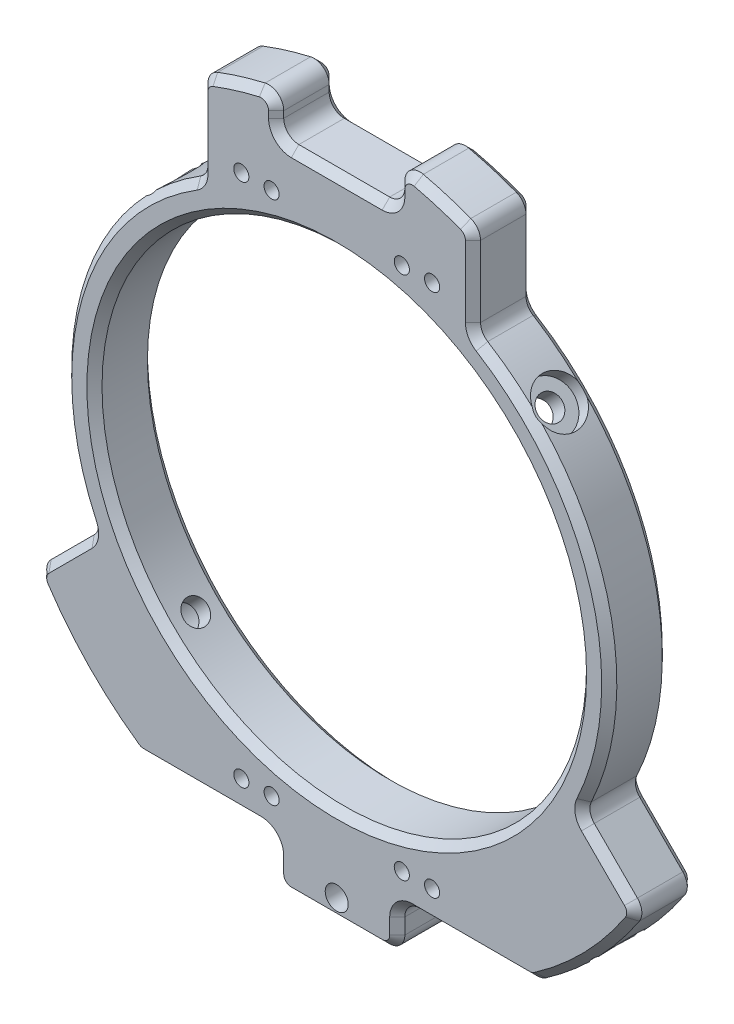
SolidWorks part; units mm, degrees
ref_plane "Front" through (0, 0, 0) normal (0, 0, 1) x (1, 0, 0)
ref_plane "Top" through (0, 0, 0) normal (0, 1, 0) x (1, 0, 0)
ref_plane "Right" through (0, 0, 0) normal (1, 0, 0) x (0, 0, -1)
ref_plane "Plane1" through (0, 0, -6.35) normal (0, 0, 1) x (1, 0, 0)
sketch "Sketch1" plane through (0, 0, 0) normal (0, 0, 1) x (1, 0, 0)
  circle A0 centre (0, 0) radius 74.0918
  circle A1 centre (0, 0) radius 50.8
  dimension "D1" = 148.1836
  dimension "D2" = 101.6
extrude "Boss-Extrude1" add sketch "Sketch1" along normal mid plane 12.7
ref_plane "Plane2" through (0, 0, 0) normal (0.7071, 0.7071, 0) x (0, 0, -1)
ref_plane "Plane3" through (52.3908, 52.3908, 0) normal (0.7071, 0.7071, 0) x (-0.7071, 0.7071, 0)
sketch "Sketch6" plane through (0, 0, 0) normal (0.7071, 0.7071, 0) x (0, 0, -1)
  circle A0 centre (0, 0) radius 2.5146
  circle A1 centre (0, 0) radius 4.7625 construction
  dimension "D1" = 5.0292
  dimension "D2" = 9.525
extrude "Cut-Extrude5" cut sketch "Sketch6" against normal through all and the other way through all
hole_wizard "CBORE for #10 Button Head Cap Screw1" positions "Sketch9" profile "Sketch8" counterbore size "#10" standard "Ansi Inch"
sketch "Sketch9" plane through (52.3908, 52.3908, 0) normal (0.7071, 0.7071, 0) x (-0.7071, 0.7071, 0)
  point P1 (0, 0)
sketch "Sketch8" plane through (52.3908, 52.3908, 0) normal (0, 0, 1) x (-0.7071, 0.7071, 0)
  line L0 (0, 0) -> (0, 52.3338)
  line L1 (0, 52.3338) -> (2.5527, 50.8)
  line L2 (2.5527, 50.8) -> (2.5527, 19.8425)
  line L3 (2.5527, 19.8425) -> (4.9606, 19.8425)
  line L4 (4.9606, 19.8425) -> (4.9606, 0)
  line L5 (4.9606, 0) -> (0, 0)
  line L10 (0, 52.3338) -> (-2.5527, 50.8) construction
  line L11 (0, -6.35) -> (0, 107.95) construction
  circle A1 centre (0, 74.0918) radius 50.8 construction
  dimension "Hole Dia." = 5.1054
  dimension "Hole Depth" = 50.8
  dimension "C'Bore Dia." = 9.9212
  dimension "C'Bore Depth" = 19.8425
  dimension "Drill Angle" = 118
pattern_circular "CirPattern2" count 4 over 360 about axis through (0, 0, 0) along (0, 0, 1) of "CBORE for #10 Button Head Cap Screw1"
sketch "Sketch3" plane through (0, 0, -6.35) normal (0, 0, -1) x (-1, 0, 0)
  line L0 (0, 0) -> (0, -84.5112) construction
  line L1 (-19.05, -67.7418) -> (-12.7, -67.7418) construction
  line L2 (-19.05, -67.7418) -> (-19.05, -80.4418) construction
  line L3 (-19.05, -80.4418) -> (-12.7, -80.4418) construction
  line L4 (-12.7, -67.7418) -> (-12.7, -80.4418) construction
  line L5 (-63.5, -55.0418) -> (-49.5983, -55.0418) construction
  line L6 (-63.5, -55.0418) -> (-63.5, -77.2668) construction
  line L7 (-63.5, -77.2668) -> (-25.4, -77.2668) construction
  line L8 (-25.4, -58.1987) -> (-25.4, -77.2668) construction
  line L9 (0, 0) -> (-20, 0) construction
  line L10 (63.5, -55.0418) -> (63.5, -77.2668) construction
  line L11 (63.5, -55.0418) -> (49.5983, -55.0418) construction
  line L12 (25.4, -58.1987) -> (25.4, -77.2668) construction
  line L13 (63.5, -77.2668) -> (25.4, -77.2668) construction
  line L14 (19.05, -80.4418) -> (12.7, -80.4418) construction
  line L15 (12.7, -67.7418) -> (12.7, -80.4418) construction
  line L16 (19.05, -67.7418) -> (12.7, -67.7418) construction
  line L17 (19.05, -67.7418) -> (19.05, -80.4418) construction
  line L27 (19.05, 67.7418) -> (19.05, 80.4418) construction
  line L28 (19.05, 67.7418) -> (12.7, 67.7418) construction
  line L29 (12.7, 67.7418) -> (12.7, 80.4418) construction
  line L30 (19.05, 80.4418) -> (12.7, 80.4418) construction
  line L31 (63.5, 77.2668) -> (25.4, 77.2668) construction
  line L32 (25.4, 58.1987) -> (25.4, 77.2668) construction
  line L33 (63.5, 55.0418) -> (49.5983, 55.0418) construction
  line L34 (63.5, 55.0418) -> (63.5, 77.2668) construction
  line L35 (-25.4, 58.1987) -> (-25.4, 77.2668) construction
  line L36 (-63.5, 77.2668) -> (-25.4, 77.2668) construction
  line L37 (-63.5, 55.0418) -> (-63.5, 77.2668) construction
  line L38 (-63.5, 55.0418) -> (-49.5983, 55.0418) construction
  line L39 (-12.7, 67.7418) -> (-12.7, 80.4418) construction
  line L40 (-19.05, 80.4418) -> (-12.7, 80.4418) construction
  line L41 (-19.05, 67.7418) -> (-19.05, 80.4418) construction
  line L42 (-19.05, 67.7418) -> (-12.7, 67.7418) construction
  circle A1 centre (0, 0) radius 50.8 construction
  circle A2 centre (-13.65, -55) radius 1.5875
  circle A3 centre (0, -66.675) radius 2.413
  circle A4 centre (13.65, -55) radius 1.5875
  circle A5 centre (20, -55) radius 1.5875
  circle A6 centre (-20, -55) radius 1.5875
  circle A7 centre (20, 55) radius 1.5875
  circle A8 centre (13.65, 55) radius 1.5875
  arc A9 (-25.4, 58.1987) -> (-25.4, -58.1987) centre (0, 0) ccw construction
  circle A10 centre (-13.65, 55) radius 1.5875
  arc A11 (25.4, -58.1987) -> (25.4, 58.1987) centre (0, 0) ccw construction
  circle A12 centre (0, 0) radius 74.0918 construction
  arc A13 (-49.5983, 55.0418) -> (-49.5983, -55.0418) centre (0, 0) ccw construction
  circle A14 centre (-20, 55) radius 1.5875
  arc A15 (49.5983, -55.0418) -> (49.5983, 55.0418) centre (0, 0) ccw construction
  dimension "D9" = 3.175
  dimension "D12" = 12.7
  dimension "D19" = 4.826
  dimension "D20" = 66.675
  dimension "D1" = 6.35
  dimension "D2" = 12.7
  dimension "D3" = 6.35
  dimension "D4" = 55
  dimension "D5" = 12.7
  dimension "D6" = 12.7
  dimension "D7" = 22.225
  dimension "D8" = 38.1
  dimension "D10" = 67.7418
  dimension "D11" = 6.35
  dimension "D16" = 20
extrude "Cut-Extrude2" cut sketch "Sketch3" against normal through all
sketch "Sketch12" plane through (0, 0, 0) normal (0, 0, 1) x (1, 0, 0)
  line L0 (0, 0) -> (0, 74.0918) construction
  line L1 (0, 0) -> (52.3908, -52.3908) construction
  line L2 (74.0918, 0) -> (0, 0) construction
  line L3 (0, 0) -> (-52.3908, -52.3908) construction
  line L4 (-12.7, 74.0918) -> (-12.7, 64.5668)
  line L5 (-12.7, 74.0918) -> (12.7, 74.0918)
  line L6 (36.6961, -61.3918) -> (38.5671, -63.2628)
  line L7 (0, 0) -> (0, -74.0918) construction
  line L8 (50.8263, -26.1306) -> (63.2628, -38.5671)
  line L9 (-28.575, 68.3598) -> (-28.575, 49.4934)
  line L10 (-36.6961, -61.3918) -> (-38.5671, -63.2628)
  line L11 (28.575, 68.3598) -> (28.575, 49.4934)
  line L12 (-12.7, 64.5668) -> (12.7, 64.5668)
  line L13 (12.7, 64.5668) -> (12.7, 74.0918)
  line L14 (-36.6961, -61.3918) -> (-12.7, -61.3918)
  line L15 (12.7, 74.0918) -> (28.575, 74.0918) construction
  line L16 (-50.8263, -26.1306) -> (-63.2628, -38.5671)
  line L17 (-12.7, -61.3918) -> (-12.7, -71.0438)
  line L18 (12.7, -61.3918) -> (12.7, -71.0438)
  line L19 (12.7, -61.3918) -> (36.6961, -61.3918)
  line L20 (-12.7, -71.0438) -> (12.7, -71.0438)
  arc A0 (50.8263, -26.1306) -> (28.575, 49.4934) centre (0, 0) ccw
  arc A1 (63.2628, -38.5671) -> (28.575, 68.3598) centre (0, 0) ccw
  circle A2 centre (0, 0) radius 74.0918 construction
  circle A3 centre (0, 0) radius 50.8 construction
  arc A4 (-28.575, 49.4934) -> (-50.8263, -26.1306) centre (0, 0) ccw
  arc A5 (-28.575, 68.3598) -> (-63.2628, -38.5671) centre (0, 0) ccw
  arc A6 (-38.5671, -63.2628) -> (38.5671, -63.2628) centre (0, 0) ccw
  arc A8 (-12.7, -69.8994) -> (12.7, -69.8994) centre (0, 0) ccw construction
  point P21 (0, 64.5668)
  dimension "D1" = 6.35
  dimension "D5" = 57.15
  dimension "D11" = 71.0438
  dimension "D12" = 3.048
  dimension "D2" = 45
  dimension "D4" = 34.925
  dimension "D6" = 9.525
  dimension "D7" = 25.4
  dimension "D3" = 45
  dimension "D8" = 28.575
  dimension "D9" = 17.4625
  dimension "D10" = 17.4625
  dimension "D13" = 12.7
extrude "Cut-Extrude7" cut sketch "Sketch12" against normal mid plane 25.4
sketch "Sketch14" plane through (0, 0, 0) normal (0, 0, 1) x (1, 0, 0)
  line L0 (-12.7, -61.3918) -> (-36.6961, -61.3918) construction
  line L1 (-20.3923, -61.3918) -> (-46.0891, -61.3918)
  line L2 (-20.3923, -61.3918) -> (-20.3923, -73.1833)
  line L3 (-20.3923, -73.1833) -> (-46.0891, -73.1833)
  line L4 (-46.0891, -61.3918) -> (-46.0891, -73.1833)
  line L5 (0, 0) -> (0, -79.7524) construction
  line L6 (46.0891, -61.3918) -> (46.0891, -73.1833)
  line L7 (20.3923, -73.1833) -> (46.0891, -73.1833)
  line L8 (20.3923, -61.3918) -> (20.3923, -73.1833)
  line L9 (20.3923, -61.3918) -> (46.0891, -61.3918)
extrude "Cut-Extrude8" cut sketch "Sketch14" against normal mid plane 50.8
fillet "Fillet1" radius 3.175 18 edges at (50.8263, -26.1306, 0) (63.2628, -38.5671, 0) (12.7, -61.3918, 0) (-12.7, -61.3918, 0) (-63.2628, -38.5671, 0) (-50.8263, -26.1306, 0) (-28.575, 49.4934, 0) (-28.575, 68.3598, 0) (-12.7, 72.9952, 0) (12.7, 72.9952, 0) (28.575, 68.3598, 0) (-12.7, 64.5668, 0) (12.7, 64.5668, 0) (28.575, 49.4934, 0) (41.4806, -61.3918, 0) (-41.4806, -61.3918, 0) (12.7, -71.0438, 0) (-12.7, -71.0438, 0)
chamfer "Chamfer1" distance 1.5875 angle 45 74 edges at (-53.0478, -51.7255, 6.35) (-62.379, -38.6932, 6.35) (-28.1859, -61.3918, 6.35) (-56.9478, -32.2521, 6.35) (-13.6299, -62.3217, 6.35) (-51.5486, -26.041, 6.35) (-12.7, -66.2178, 6.35) (-54.7612, 16.3502, 6.35) (-28.9764, 49.7485, 6.35) (-28.575, 58.7529, 6.35) (-28.0164, 68.0106, 6.35) (12.7, -66.2178, 6.35) (-21.6148, 70.8689, 6.35) (13.6299, -62.3217, 6.35) (-13.8971, 71.6008, 6.35) (28.1859, -61.3918, 6.35) (-12.7, 68.4295, 6.35) (-11.7701, 65.4967, 6.35) (0, 64.5668, 6.35) (53.0478, -51.7255, 6.35) (11.7701, 65.4967, 6.35) (62.379, -38.6932, 6.35) (12.7, 68.4295, 6.35) (56.9478, -32.2521, 6.35) (13.8971, 71.6008, 6.35) (51.5486, -26.041, 6.35) (21.6148, 70.8689, 6.35) (54.7612, 16.3502, 6.35) (28.0164, 68.0106, 6.35) (28.9764, 49.7485, 6.35) (28.575, 58.7529, 6.35) (-53.0478, -51.7255, -6.35) (-62.379, -38.6932, -6.35) (-28.1859, -61.3918, -6.35) (-56.9478, -32.2521, -6.35) (-13.6299, -62.3217, -6.35) (-51.5486, -26.041, -6.35) (-12.7, -66.2178, -6.35) (-54.7612, 16.3502, -6.35) (-28.9764, 49.7485, -6.35) (-28.575, 58.7529, -6.35) (-28.0164, 68.0106, -6.35) (12.7, -66.2178, -6.35) (-21.6148, 70.8689, -6.35) (13.6299, -62.3217, -6.35) (-13.8971, 71.6008, -6.35) (28.1859, -61.3918, -6.35) (-12.7, 68.4295, -6.35) (-11.7701, 65.4967, -6.35) (0, 64.5668, -6.35) (53.0478, -51.7255, -6.35) (11.7701, 65.4967, -6.35) (62.379, -38.6932, -6.35) (12.7, 68.4295, -6.35) (56.9478, -32.2521, -6.35) (13.8971, 71.6008, -6.35) (51.5486, -26.041, -6.35) (21.6148, 70.8689, -6.35) (54.7612, 16.3502, -6.35) (28.0164, 68.0106, -6.35) (28.9764, 49.7485, -6.35) (28.575, 58.7529, -6.35) (50.8, 0, 6.35) (50.8, 0, -6.35) (-41.4469, -61.2463, 6.35) (41.4469, -61.2463, 6.35) (-41.4469, -61.2463, -6.35) (41.4469, -61.2463, -6.35) (-11.7701, -70.1139, 6.35) (0, -71.0438, 6.35) (11.7701, -70.1139, 6.35) (-11.7701, -70.1139, -6.35) (0, -71.0438, -6.35) (11.7701, -70.1139, -6.35)
sketch "Sketch13" plane through (0, 0, 0) normal (0, 0, 1) x (1, 0, 0)
  line L0 (9.525, -71.0438) -> (-9.525, -71.0438) construction
  line L1 (-62.3953, 72.2921) -> (62.3953, 72.2921)
  line L2 (-62.3953, 72.2921) -> (-62.3953, -71.0438)
  line L3 (-62.3953, -71.0438) -> (62.3953, -71.0438)
  line L4 (62.3953, 72.2921) -> (62.3953, -71.0438)
  arc A0 (61.8716, -40.7614) -> (61.4654, -36.7697) centre (59.2203, -39.0147) ccw construction
  arc A2 (-61.4654, -36.7697) -> (-61.8716, -40.7614) centre (-59.2203, -39.0147) ccw construction
  arc A3 (16.5857, 72.2116) -> (12.7, 69.1171) centre (15.875, 69.1171) ccw construction
